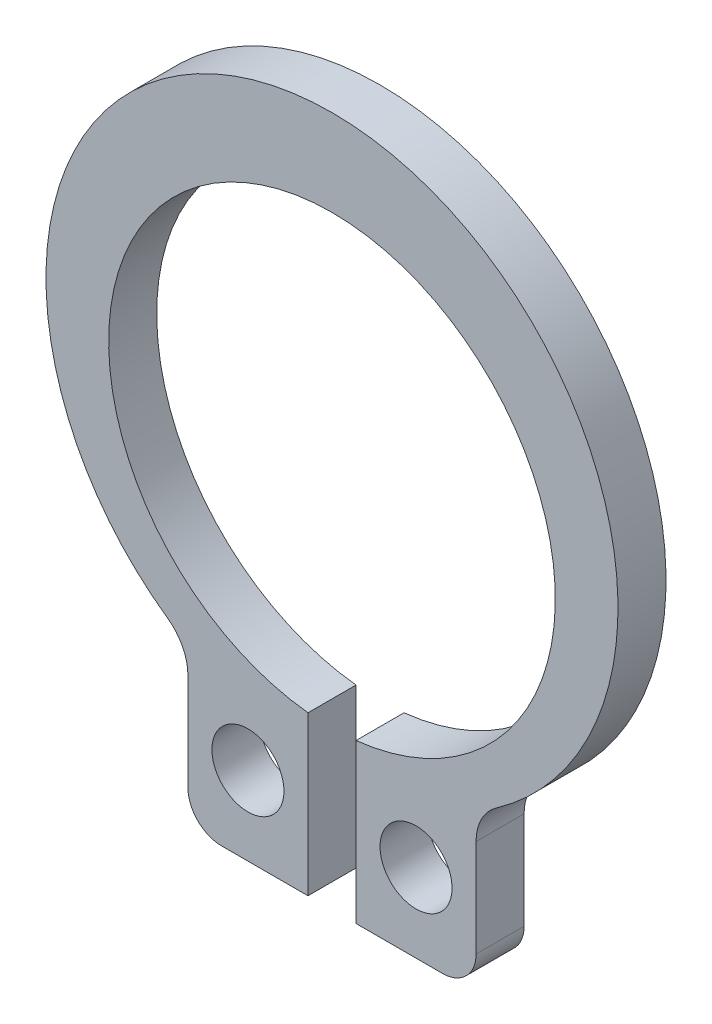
SolidWorks part; units mm, degrees
ref_plane "Front Plane" through (0, 0, 0) normal (0, 0, 1) x (1, 0, 0)
ref_plane "Top Plane" through (0, 0, 0) normal (0, 1, 0) x (1, 0, 0)
ref_plane "Right Plane" through (0, 0, 0) normal (1, 0, 0) x (0, 0, -1)
sketch "BodySke" plane through (0, 0, 0) normal (0, 0, 1) x (1, 0, 0)
  line L0 (0, 0) -> (0, 21.0564) construction
  line L1 (0, 0) -> (0, -11.0385) construction
  line L2 (-0.5, -4.623) -> (-0.5, -7.923)
  line L3 (-0.5, -7.923) -> (-3, -7.923)
  line L4 (-3, -7.923) -> (-3, -4.6491)
  line L5 (3, -6.2861) -> (3.9811, -6.2861) construction
  line L7 (0.5, -7.923) -> (3, -7.923)
  line L8 (0.5, -4.623) -> (0.5, -7.923)
  line L9 (3, -7.923) -> (3, -4.6491)
  arc A0 (0.5, -4.623) -> (-0.5, -4.623) centre (0, 0) ccw
  circle A2 centre (-1.75, -6.2861) radius 0.75
  circle A3 centre (1.75, -6.2861) radius 0.75
  arc A4 (3, -4.6491) -> (-3, -4.6491) centre (0, 0.495) ccw
  dimension "D1" = 0.5
  dimension "Groove_Diameter" = 9.3
  dimension "D2" = 0.5
  dimension "D3" = 5.955
  dimension "dia" = 1.5
  dimension "Groove_Depth" = 1.8
  dimension "Thickness" = 1
  dimension "Groove_length" = 3.3
extrude "BaseBody" add sketch "BodySke" along normal blind 1
fillet "Fillet1" radius 1 2 edges at (3, -4.6491, 0.5) (-3, -4.6491, 0.5)
fillet "Fillet2" radius 0.7 2 edges at (3, -7.923, 0.5) (-3, -7.923, 0.5)
equation "\"D1@BodySke\" = \"Thickness@BodySke\" / 2"
equation "\"D2@BodySke\" = \"Thickness@BodySke\" / 2"
equation "\"D3@BodySke\" =  ( \"Groove_Diameter@BodySke\" + 1.45 * \"Groove_Depth@BodySke\" )  / 2"
equation "\"Thickness@BaseBody\" = \"Thickness@BodySke\""
equation "\"D1@Fillet1\" = \"Thickness@BodySke\""
equation "\"D1@Fillet2\" = \"Thickness@BodySke\" * 0.7"
